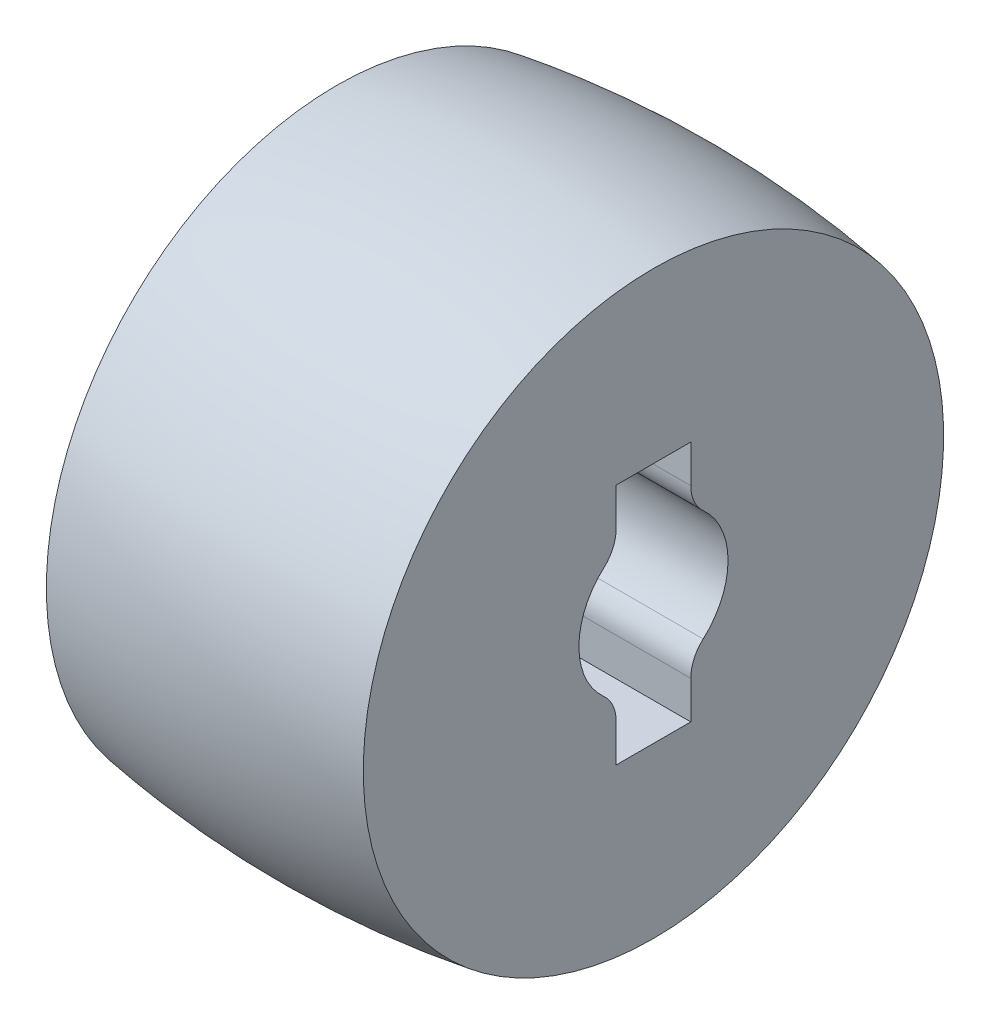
SolidWorks part; units mm, degrees
ref_plane "Front Plane" through (0, 0, 0) normal (0, 0, 1) x (1, 0, 0)
ref_plane "Top Plane" through (0, 0, 0) normal (0, 1, 0) x (1, 0, 0)
ref_plane "Right Plane" through (0, 0, 0) normal (1, 0, 0) x (0, 0, -1)
sketch "Sketch1" plane through (0, 0, 0) normal (0, 0, 1) x (1, 0, 0)
  line L0 (19.5035, 0) -> (-19.5035, 0) construction
  line L1 (8.75, 6.6837) -> (8.75, 0)
  line L2 (4.25, 7.7825) -> (4.25, 0)
  line L3 (-4.25, 7.7825) -> (-4.25, 0)
  line L4 (-8.75, 6.6837) -> (-8.75, 0)
  line L5 (19.5035, 0) -> (-19.5035, 0)
  arc A0 (19.5035, 0) -> (-19.5035, 0) centre (0, -19.3872) ccw
revolve "Revolve1" add sketch "Sketch1" angle 360 about L0
sketch "Sketch2" plane through (-4.25, 0, 0) normal (-1, 0, 0) x (0, 0, 1)
  line L0 (1, 0) -> (0, 0) construction
  line L1 (-1, 3.25) -> (1, 3.25)
  line L2 (-1, 3.25) -> (-1, -3.25)
  line L3 (-1, -3.25) -> (1, -3.25)
  line L4 (1, 3.25) -> (1, -3.25)
  line L5 (0, 0) -> (-1, 0) construction
  circle A0 centre (0, 0) radius 2
  dimension "D1" = 4
  dimension "D2" = 6.5
  dimension "D3" = 2
extrude "Cut-Extrude1" cut sketch "Sketch2" against normal through all both and the other way through all contours L4 A0 L2 | A0 L4 L1 L2 | L2 A0 | L4 A0 | A0 L2 L3 L4
fillet "Fillet1" radius 1 4 edges at (0, -1.7321, 1) (0, 1.7321, 1) (0, -1.7321, -1) (0, 1.7321, -1)
equation "\"wheelDia\"= 55"
equation "\"D1@Sketch1\"=\"wheelDia\"/1.41"
equation "\"D2@Sketch1\"=\"wheelDia\"/2"
